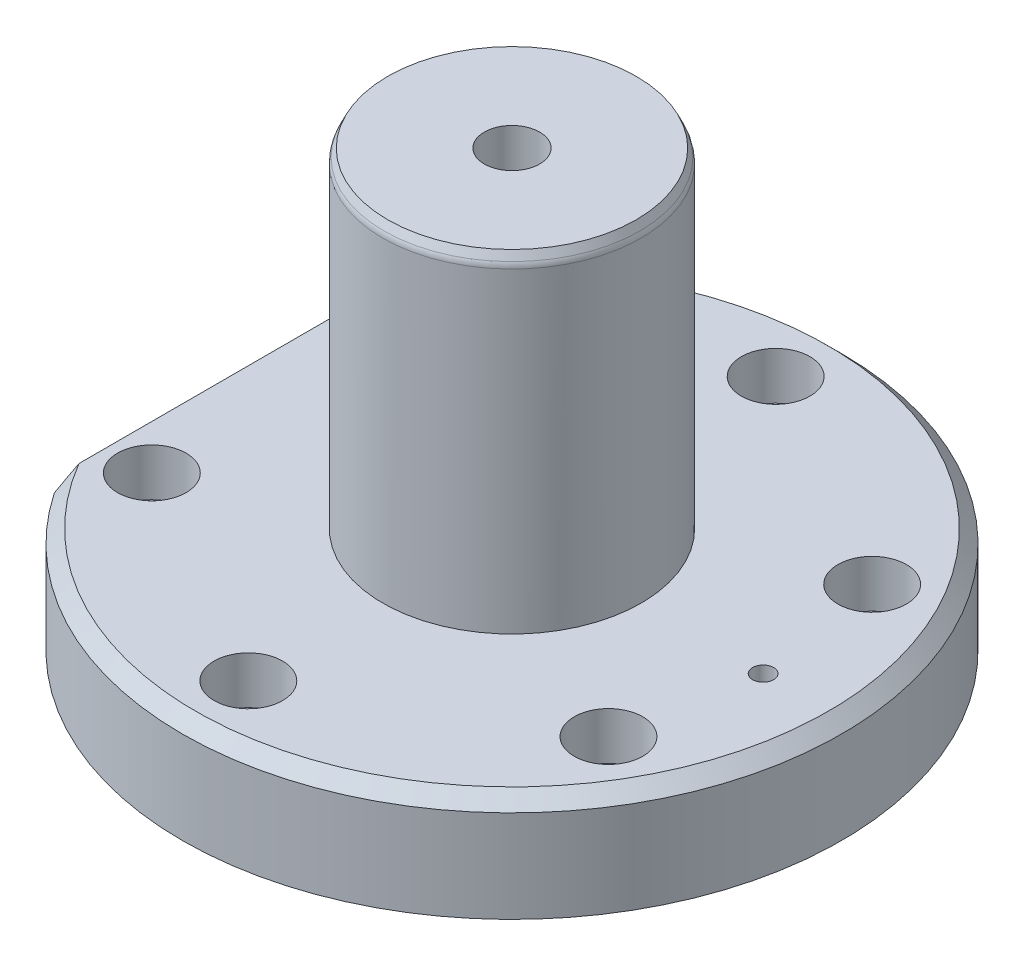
SolidWorks part; units mm, degrees
ref_plane "Plan de face" through (0, 0, 0) normal (0, 0, 1) x (1, 0, 0)
ref_plane "Plan de dessus" through (0, 0, 0) normal (0, 1, 0) x (1, 0, 0)
ref_plane "Plan de droite" through (0, 0, 0) normal (1, 0, 0) x (0, 0, -1)
sketch "Esquisse1" plane through (0, 0, 0) normal (0, 0, 1) x (1, 0, 0)
  line L0 (0, 0) -> (0, 331.0969) construction
  line L1 (-156.5, 50) -> (156.5, 50) construction
  line L2 (15, 50) -> (125, 50)
  line L3 (0, 40) -> (0, 215)
  line L4 (49, 90) -> (125, 90)
  line L5 (125, 50) -> (125, 90)
  line L6 (49, 199.5) -> (49, 217) construction
  line L7 (-78.5, 90) -> (78.5, 90) construction
  line L8 (49, 215) -> (49, 90)
  line L10 (0, 215) -> (49, 215)
  line L12 (15, 50) -> (15, 40)
  line L13 (15, 0) -> (15, 50) construction
  line L14 (15, 40) -> (0, 40)
  line L15 (-45, 217) -> (45, 217) construction
  dimension "D1" = 250
  dimension "D2" = 2
  dimension "D3" = 10
revolve "Révolution1" add sketch "Esquisse1" angle 360 about L0
chamfer "Chanfrein1" distance 4 angle 25 1 edges at (0, 215, -49)
chamfer "Chanfrein2" distance 5 angle 45 1 edges at (0, 90, -125)
chamfer "Chanfrein3" distance 3 angle 30 1 edges at (0, 40, -15)
hole_wizard "Trou taraudé M241" positions "Esquisse4" profile "Esquisse3" tap size "M24" standard "ISO"
sketch "Esquisse4" plane through (0, 215, 0) normal (0, 1, 0) x (-1, 0, 0)
  point P0 (0, 0)
sketch "Esquisse3" plane through (0, 215, 0) normal (1, 0, 0) x (0, 0, 1)
  line L0 (0, 0) -> (0, 69.309)
  line L1 (0, 69.309) -> (10.5, 63)
  line L2 (10.5, 63) -> (10.5, 0)
  line L5 (10.5, 0) -> (0, 0)
  line L10 (0, 69.309) -> (-10.5, 63) construction
  line L11 (0, -6.35) -> (0, 107.95) construction
  dimension "Diamètre du trou pour taraudage" = 21
  dimension "Profondeur du trou pour taraudage" = 63
  dimension "Angle de pointe" = 118
sketch "Esquisse5" plane through (0, 0, 0) normal (0, 0, 1) x (1, 0, 0)
  line L0 (-113.5, 117) -> (-113.5, 91.6) construction
  line L1 (-125, 50) -> (-103.5, 50)
  line L2 (-125, 50) -> (-125, 90)
  line L3 (-125, 90) -> (-103.5, 90)
  line L4 (-103.5, 50) -> (-103.5, 90)
  line L5 (-125, 85) -> (-125, 50) construction
  line L7 (120, 90) -> (-120, 90) construction
  dimension "D1" = 10
extrude "Enlèv. mat.-Extru.1" cut sketch "Esquisse5" against normal up to next and the other way up to next
hole_wizard "Diamètre du perçage Ø8.0 (8)1" positions "Esquisse7" profile "Esquisse6" hole size "Ø8.0" standard "ISO"
sketch "Esquisse7" plane through (0, 90, 0) normal (0, 1, 0) x (-1, 0, 0)
  point P1 (-95.25, 0)
sketch "Esquisse6" plane through (95.25, 90, 0) normal (1, 0, 0) x (0, 0, 1)
  line L0 (0, 0) -> (0, 40)
  line L1 (0, 40) -> (4, 40)
  line L2 (4, 40) -> (4, 0)
  line L5 (4, 0) -> (0, 0)
  line L11 (0, -6.35) -> (0, 107.95) construction
  dimension "Diamètre du perçage jusqu'au prochain" = 8
  dimension "Profondeur du perçage jusqu'au prochain" = 40
hole_wizard "Chambrage pour vis à tête hexagonale M162" positions "Esquisse8" profile "Esquisse9" counterbore size "M16" standard "ISO"
sketch "Esquisse8" plane through (0, 90, 0) normal (0, 1, 0) x (0, 0, -1)
  line L0 (0, 0) -> (-50, 86.6025) construction
  line L1 (0, 0) -> (0, -100) construction
  circle A0 centre (0, 0) radius 100 construction
  point P0 (-50, -86.6025)
  point P1 (-50, 86.6025)
  point P19 (50, 86.6025)
  point P21 (50, -86.6025)
  point P23 (100, 0)
  point P25 (-100, 0)
sketch "Esquisse9" plane through (86.6025, 90, 50) normal (1, 0, 0) x (0, 0, 1)
  line L0 (0, 0) -> (0, 50)
  line L1 (0, 50) -> (8.75, 50)
  line L3 (8.75, 50) -> (8.75, 18)
  line L4 (8.75, 18) -> (13, 18)
  line L5 (13, 18) -> (13, 0)
  line L7 (13, 0) -> (0, 0)
  line L11 (0, -6.35) -> (0, 107.95) construction
  dimension "Diamètre du perçage jusqu'au prochain" = 17.5
  dimension "Profondeur du perçage jusqu'au prochain" = 50
  dimension "Diamètre du chambrage" = 26
  dimension "Profondeur du chambrage" = 18
fillet "Congé1" radius 5 1 edges at (0, 211, 49)
